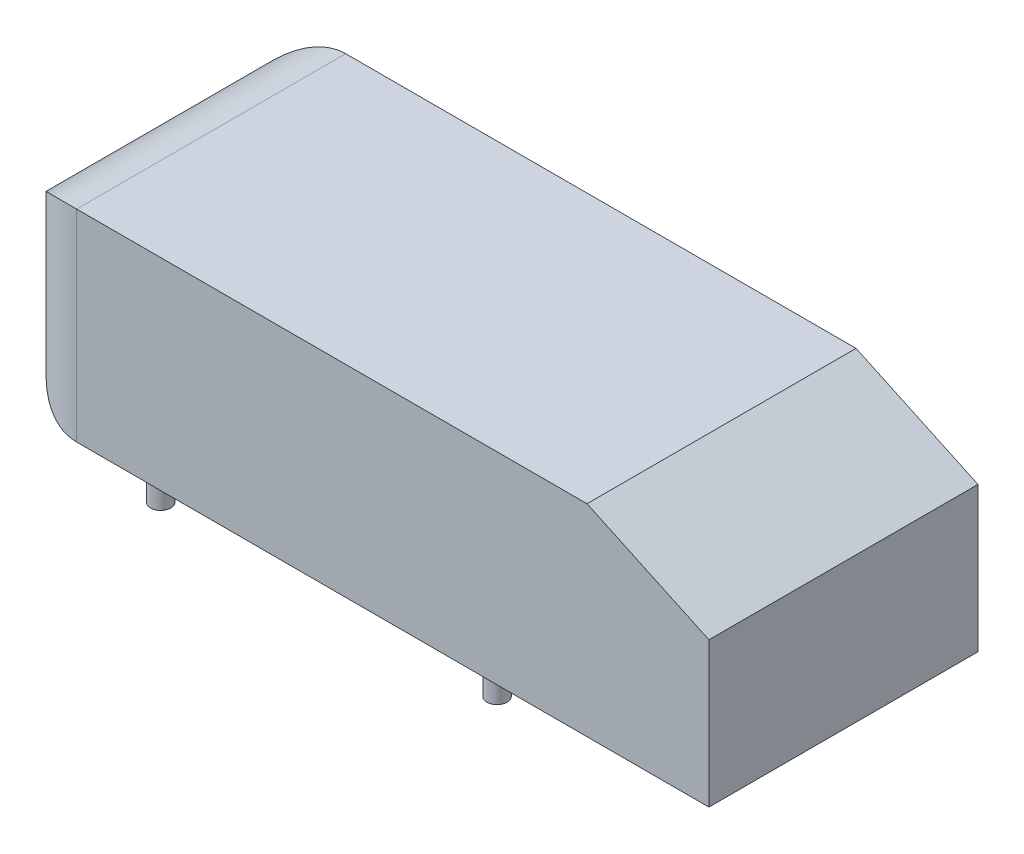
SolidWorks part; units mm, degrees
ref_plane "Front Plane" through (0, 0, 0) normal (0, 0, 1) x (1, 0, 0)
ref_plane "Top Plane" through (0, 0, 0) normal (0, 1, 0) x (1, 0, 0)
ref_plane "Right Plane" through (0, 0, 0) normal (1, 0, 0) x (0, 0, -1)
sketch "Sketch3" plane through (0, 0, 0) normal (1, 0, 0) x (0, 0, -1)
  line L1 (-200, 350) -> (200, 350)
  line L2 (-200, 350) -> (-200, 50)
  line L3 (-200, 50) -> (200, 50)
  line L4 (200, 350) -> (200, 50)
  dimension "D1" = 400
  dimension "D2" = 300
  dimension "D3" = 50
  dimension "D4" = 200
extrude "Boss-Extrude1" add sketch "Sketch3" against normal blind 1050
fillet "Fillet1" radius 110 4 edges at (-1050, 200, -200) (-1050, 50, 0) (-1050, 200, 200) (-1050, 350, 0)
sketch "Sketch4" plane through (0, 0, 0) normal (0, 0, 1) x (1, 0, 0)
  line L0 (0, 350) -> (0, 265.4763)
  line L1 (-940, 350) -> (0, 350) construction
  line L2 (0, 350) -> (0, 50) construction
  line L3 (0, 265.4763) -> (-181.2616, 350)
  line L4 (-181.2616, 350) -> (0, 350)
  dimension "D1" = 200
  dimension "D2" = 25
extrude "Cut-Extrude1" cut sketch "Sketch4" against normal through all both and the other way through all
sketch "Sketch6" plane through (0, 50, 0) normal (0, -1, 0) x (1, 0, 0)
  line L0 (0, 0) -> (-1228.1266, 0) construction
  line L1 (-1050, -90) -> (-1050, 90) construction
  circle A0 centre (-850, 165) radius 15
  circle A1 centre (-350, 165) radius 15
  circle A2 centre (-350, -165) radius 15
  circle A3 centre (-850, -165) radius 15
  dimension "D1" = 30
  dimension "D2" = 200
  dimension "D3" = 500
  dimension "D4" = 165
extrude "Boss-Extrude2" add sketch "Sketch6" along normal blind 50
